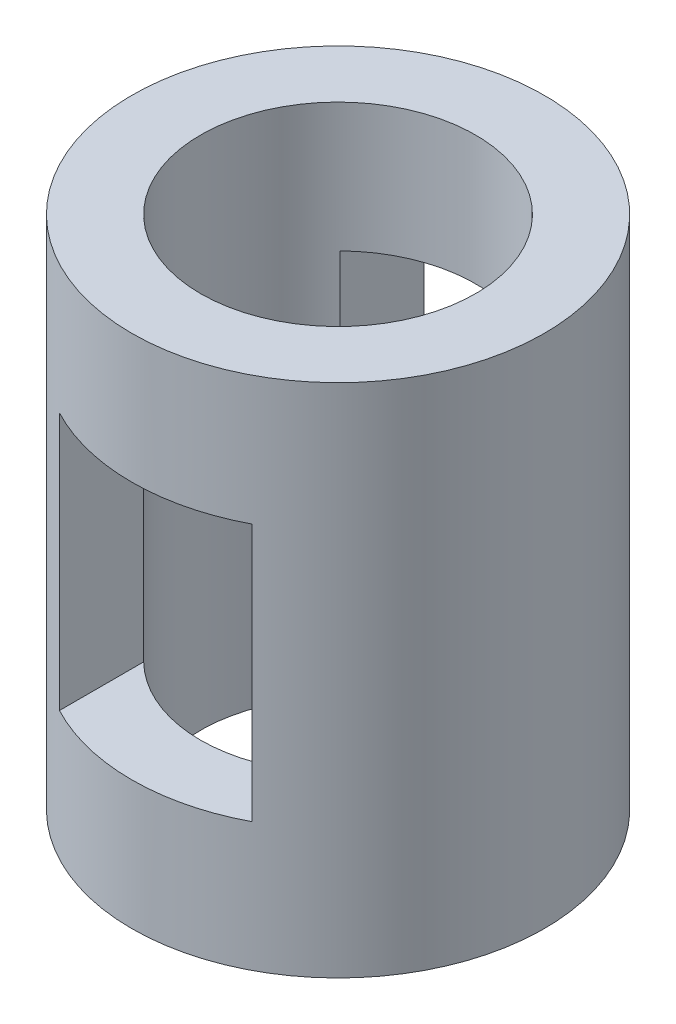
SolidWorks part; units mm, degrees
ref_plane "前视基准面" through (0, 0, 0) normal (0, 0, 1) x (1, 0, 0)
ref_plane "上视基准面" through (0, 0, 0) normal (0, 1, 0) x (1, 0, 0)
ref_plane "右视基准面" through (0, 0, 0) normal (1, 0, 0) x (0, 0, -1)
sketch "草图1" plane through (0, 0, 0) normal (0, 1, 0) x (1, 0, 0)
  circle A0 centre (0, 0) radius 30
  dimension "D1" = 60
extrude "拉伸1" add sketch "草图1" along normal blind 75
sketch "草图4" plane through (0, 0, 0) normal (0, 0, 1) x (1, 0, 0)
  line L0 (0, 0) -> (0, 80.0847) construction
  line L1 (-14, 56.25) -> (14, 56.25)
  line L2 (-14, 56.25) -> (-14, 18.75)
  line L3 (-14, 18.75) -> (14, 18.75)
  line L4 (14, 56.25) -> (14, 18.75)
  line L6 (30, 75) -> (-30, 75) construction
  dimension "D1" = 37.5
  dimension "D2" = 18.75
  dimension "D3" = 28
extrude "切除-拉伸3" cut sketch "草图4" against normal mid plane 60
sketch "草图5" plane through (0, 75, 0) normal (0, 1, 0) x (1, 0, 0)
  circle A0 centre (0, 0) radius 20
  dimension "D1" = 40
extrude "切除-拉伸4" cut sketch "草图5" against normal through all
